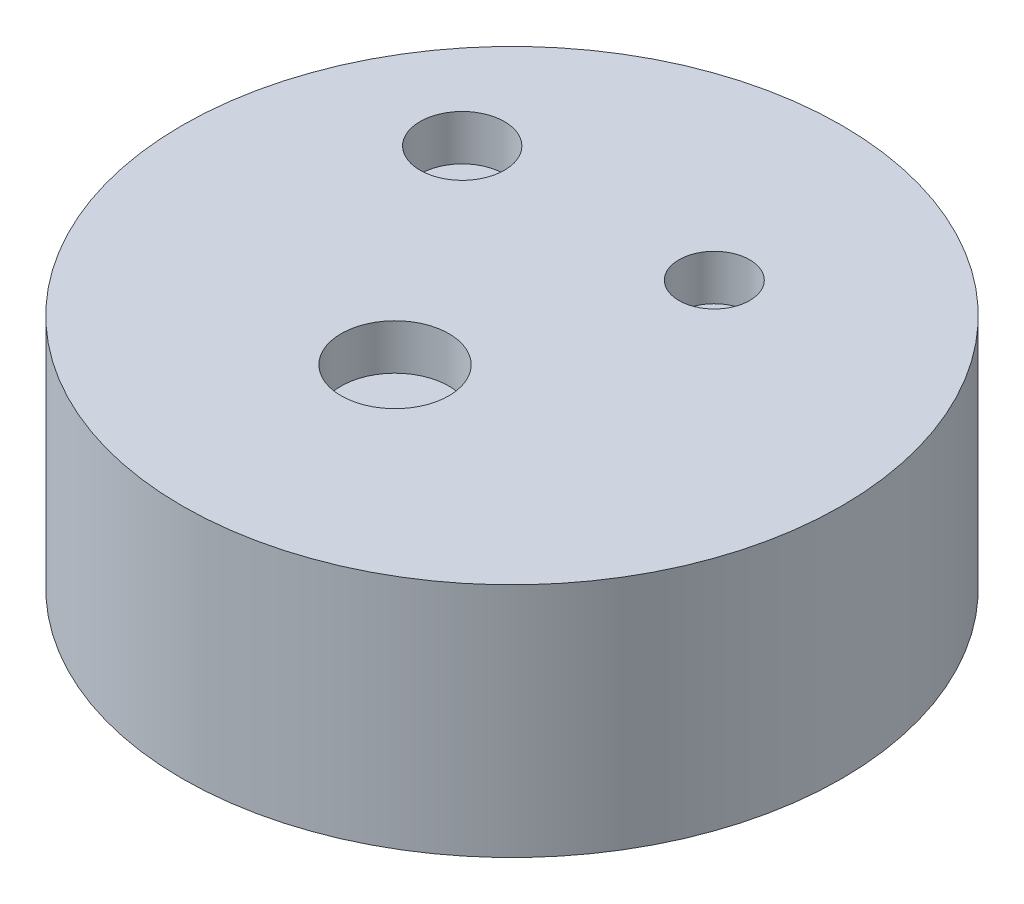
SolidWorks part; units mm, degrees
ref_plane "Front Plane" through (0, 0, 0) normal (0, 0, 1) x (1, 0, 0)
ref_plane "Top Plane" through (0, 0, 0) normal (0, 1, 0) x (1, 0, 0)
ref_plane "Right Plane" through (0, 0, 0) normal (1, 0, 0) x (0, 0, -1)
sketch "Sketch1" plane through (0, 0, 0) normal (0, 1, 0) x (1, 0, 0)
  circle A0 centre (0, 0) radius 36.8717
extrude "Boss-Extrude1" add sketch "Sketch1" along normal blind 26.416
sketch "Sketch2" plane through (0, 26.416, 0) normal (0, 1, 0) x (1, 0, 0)
  circle A0 centre (-19.2212, 13.6555) radius 4.7194
  circle A1 centre (7.8766, 14.7482) radius 3.9562
  circle A2 centre (-1.7864, -11.2952) radius 6.0255
extrude "Cut-Extrude1" cut sketch "Sketch2" against normal blind 5.08
sketch "Sketch3" plane through (0, 26.416, 0) normal (0, 1, 0) x (1, 0, 0)
  circle A0 centre (0, 0) radius 62.055
